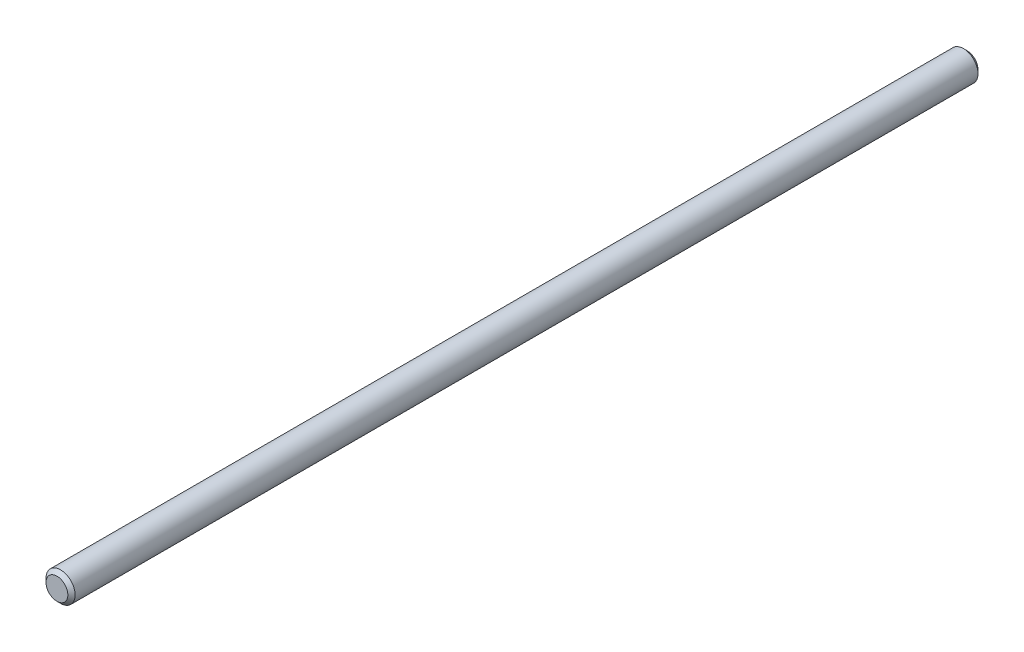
SolidWorks part; units mm, degrees
ref_plane "前视基准面" through (0, 0, 0) normal (0, 0, 1) x (1, 0, 0)
ref_plane "上视基准面" through (0, 0, 0) normal (0, 1, 0) x (1, 0, 0)
ref_plane "右视基准面" through (0, 0, 0) normal (1, 0, 0) x (0, 0, -1)
sketch "草图1" plane through (0, 0, 0) normal (0, 0, 1) x (1, 0, 0)
  circle A0 centre (0, 0) radius 2
extrude "凸台-拉伸1" add sketch "草图1" against normal blind 125
chamfer "倒角1" distance 0.5 angle 45 2 edges at (2, 0, -125) (2, 0, 0)
